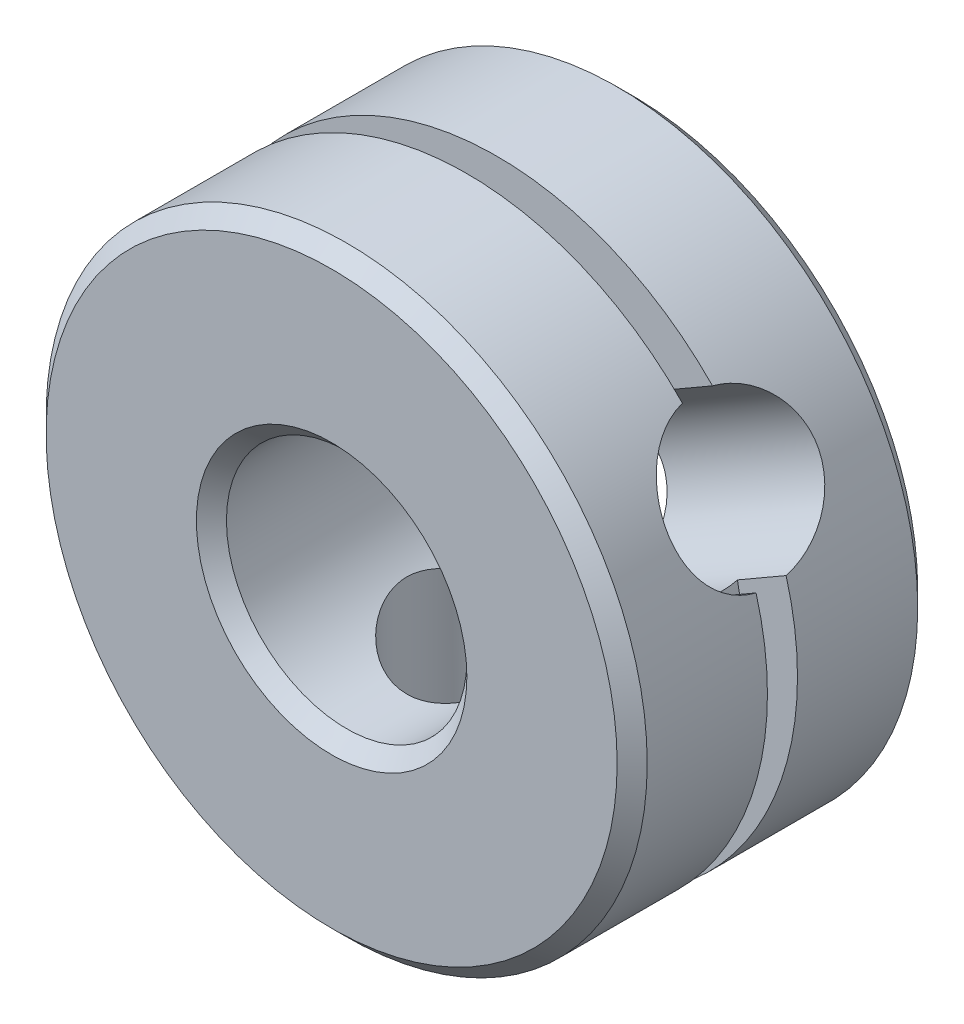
SolidWorks part; units mm, degrees
ref_plane "Front" through (0, 0, 0) normal (0, 0, 1) x (1, 0, 0)
ref_plane "Top" through (0, 0, 0) normal (0, 1, 0) x (1, 0, 0)
ref_plane "Right" through (0, 0, 0) normal (1, 0, 0) x (0, 0, -1)
sketch "Sketch1" plane through (0, 0, 0) normal (0, 0, 1) x (1, 0, 0)
  circle A0 centre (0, 0) radius 10
  circle A1 centre (0, 0) radius 4
  dimension "d" = 8
  dimension "D0" = 20
extrude "Base-Extrude" add sketch "Sketch1" against normal blind 10
chamfer "Chamfer1" distance 0.5 angle 45 2 edges at (10, 0, -10) (10, 0, 0)
sketch "Sketch2" plane through (0, 0, 0) normal (0, 1, 0) x (1, 0, 0)
  line L0 (9.5, 10) -> (-9.5, 10) construction
  line L1 (0, 3.5505) -> (0, -10.3547) construction
  circle A0 centre (0, 5) radius 2.5
  dimension "d0" = 5
  dimension "H/2" = 5
extrude "Hole" cut sketch "Sketch2" against normal through all
pattern_circular "HolePat" count 2 every 120 about axis through (0, 0, -10) along (0, 0, 1) of "Hole"
chamfer "EndChamfer" distance 0.5 angle 45 2 edges at (4, 0, -10) (4, 0, 0)
sketch "Sketch3" plane through (0, 0, 0) normal (0, 1, 0) x (1, 0, 0)
  line L1 (-10, 5.5) -> (-8.2, 5.5)
  line L2 (-10, 5.5) -> (-10, 4.5)
  line L3 (-10, 4.5) -> (-8.2, 4.5)
  line L4 (-8.2, 5.5) -> (-8.2, 4.5)
  line L6 (0, 2.3593) -> (0, -11.0317) construction
  line L8 (9.5, 10) -> (-9.5, 10) construction
  line L9 (-10, 9.5) -> (-10, 0.5) construction
  dimension "b" = 1
  dimension "D2" = 4.5
  dimension "t" = 1.8
revolve "Slot" cut sketch "Sketch3" angle 360 about L6
equation "\"H/2@Sketch2\" = \"H@Base-Extrude\" / 2"
equation "\"D2@Sketch3\" =  ( \"H@Base-Extrude\"  - \"b@Sketch3\" ) / 2"
